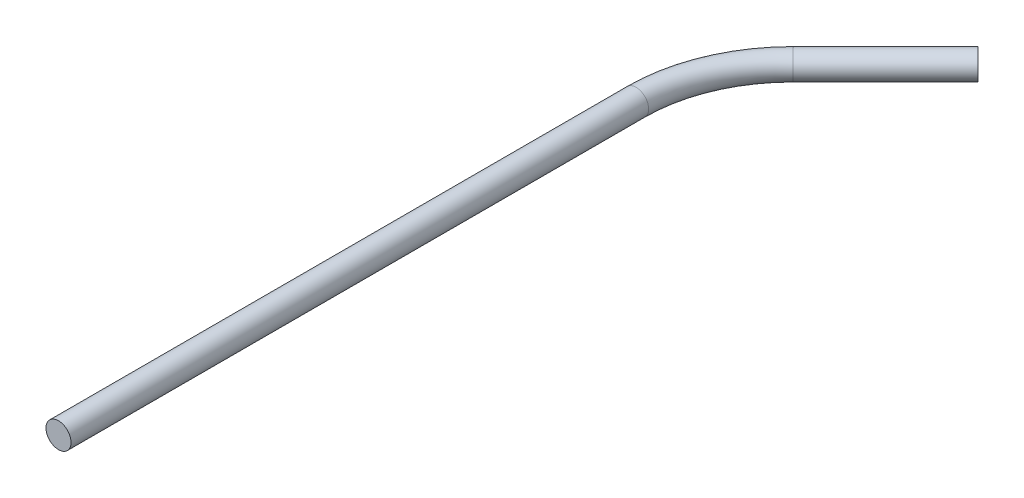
SolidWorks part; units mm, degrees
ref_plane "Front Plane" through (0, 0, 0) normal (0, 0, 1) x (1, 0, 0)
ref_plane "Top Plane" through (0, 0, 0) normal (0, 1, 0) x (1, 0, 0)
ref_plane "Right Plane" through (0, 0, 0) normal (1, 0, 0) x (0, 0, -1)
sketch "Sketch1" plane through (0, 0, 0) normal (0, 0, 1) x (1, 0, 0)
  circle A0 centre (0, 0) radius 0.8
  dimension "D1" = 1.6
sketch "Sketch2" plane through (0, 0, 0) normal (0, 1, 0) x (1, 0, 0)
  line L0 (0, 0) -> (0, 36.8579)
  line L1 (2.9289, 43.9289) -> (8.8388, 49.8388)
  arc A0 (0, 36.8579) -> (2.9289, 43.9289) centre (10, 36.8579) cw
  point P6 (0, 41)
  dimension "D4" = 10
  dimension "D1" = 41
  dimension "D2" = 135
  dimension "D3" = 12.5
sweep "Sweep1" add profiles "Sketch1" path "Sketch2"
